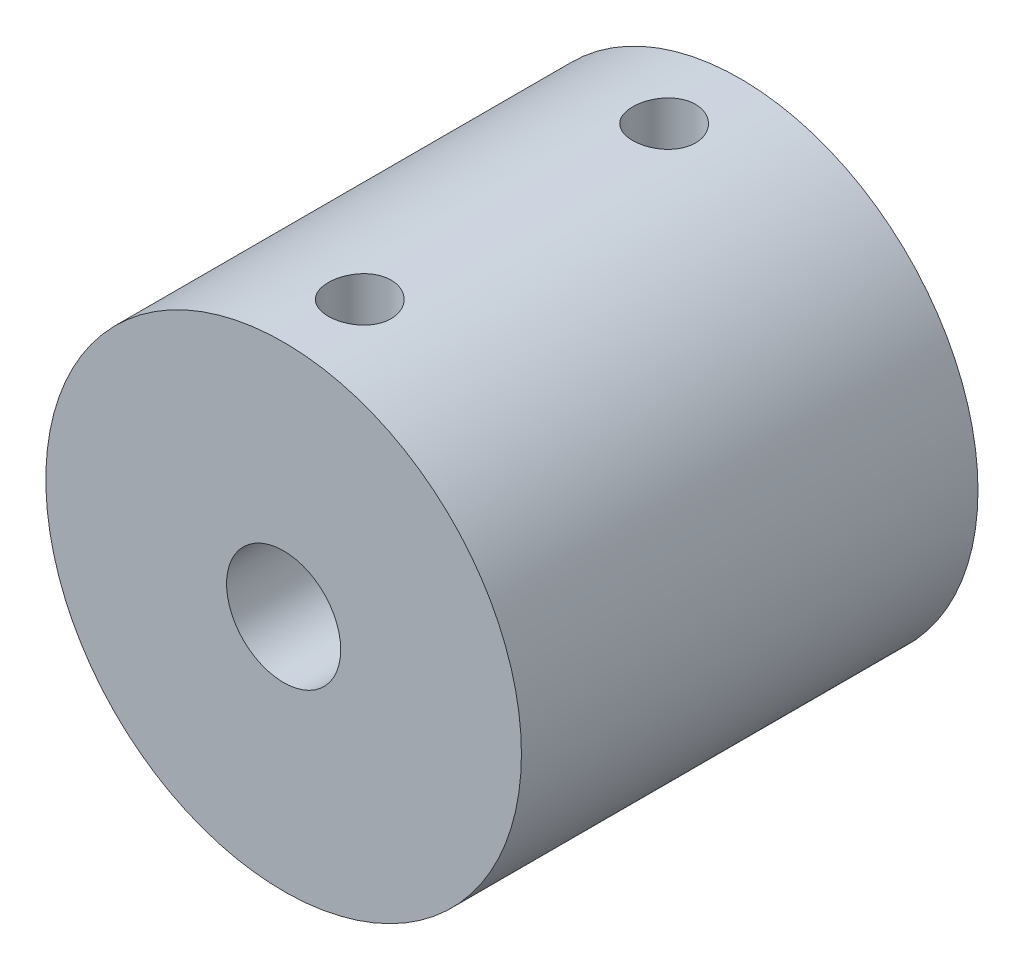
SolidWorks part; units mm, degrees
ref_plane "Piano frontale" through (0, 0, 0) normal (0, 0, 1) x (1, 0, 0)
ref_plane "Piano superiore" through (0, 0, 0) normal (0, 1, 0) x (1, 0, 0)
ref_plane "Piano destro" through (0, 0, 0) normal (1, 0, 0) x (0, 0, -1)
sketch "Schizzo1" plane through (0, 0, 0) normal (0, 0, 1) x (1, 0, 0)
  circle A0 centre (0, 0) radius 12.5
  circle A1 centre (0, 0) radius 3
  dimension "D1" = 25
  dimension "D2" = 6
extrude "Estrusione-Estrusione1" add sketch "Schizzo1" along normal blind 24
ref_plane "Piano1" through (0, 12.5, 0) normal (0, 1, 0) x (1, 0, 0)
hole_wizard "Foro filettato M4-1" positions "Schizzo2" profile "Schizzo3" tap size "M4" standard "ISO"
sketch "Schizzo2" plane through (0, 12.5, 0) normal (0, 1, 0) x (1, 0, 0)
  line L0 (12.5, 0) -> (-12.5, 0) construction
  line L1 (-12.5, -24) -> (12.5, -24) construction
  point P0 (0, -4)
  point P2 (0, -20)
  dimension "D1" = 4
  dimension "D2" = 4
sketch "Schizzo3" plane through (0, 12.5, 4) normal (1, 0, 0) x (0, 0, 1)
  line L0 (0, 0) -> (0, 9.5)
  line L1 (0, 9.5) -> (1.65, 9.5)
  line L2 (1.65, 9.5) -> (1.65, 0)
  line L5 (1.65, 0) -> (0, 0)
  line L11 (0, -6.35) -> (0, 107.95) construction
  dimension "Thru Tap Drill Dia." = 3.3
  dimension "Thru Tap Drill Depth" = 9.5
